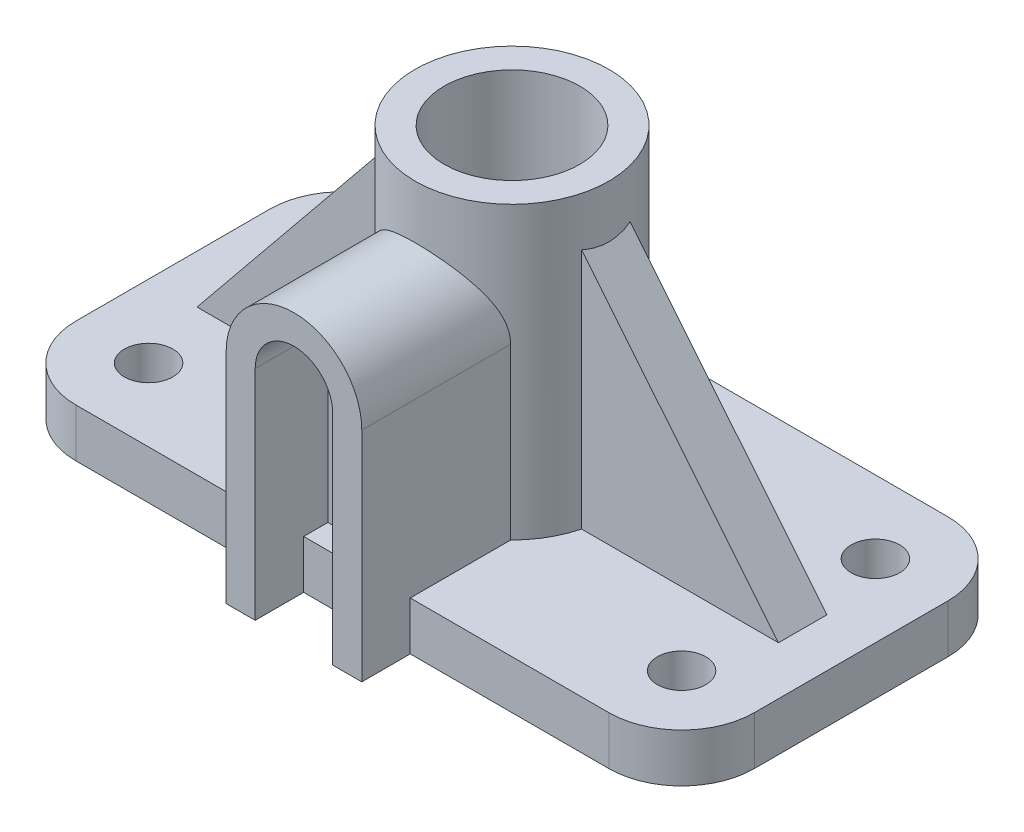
SolidWorks part; units mm, degrees
ref_plane "前视基准面" through (0, 0, 0) normal (0, 0, 1) x (1, 0, 0)
ref_plane "上视基准面" through (0, 0, 0) normal (0, 1, 0) x (1, 0, 0)
ref_plane "右视基准面" through (0, 0, 0) normal (1, 0, 0) x (0, 0, -1)
sketch "草图1" plane through (0, 0, 0) normal (0, 1, 0) x (1, 0, 0)
  line L0 (0, 0) -> (120.431, 0) construction
  line L1 (-55, 35) -> (55, 35)
  line L2 (-70, 20) -> (-70, -20)
  line L3 (-55, -35) -> (55, -35)
  line L4 (70, 20) -> (70, -20)
  line L5 (0, 0) -> (0, 97.1477) construction
  arc A0 (-70, 20) -> (-55, 35) centre (-55, 20) cw
  arc A1 (-55, -35) -> (-70, -20) centre (-55, -20) cw
  arc A2 (70, 20) -> (55, 35) centre (55, 20) ccw
  arc A3 (55, -35) -> (70, -20) centre (55, -20) ccw
  circle A4 centre (55, 20) radius 5
  circle A5 centre (55, -20) radius 5
  circle A6 centre (-55, 20) radius 5
  circle A7 centre (-55, -20) radius 5
  point P10 (-70, 35)
  point P15 (70, 35)
  dimension "D3" = 15
  dimension "D4" = 15
  dimension "D5" = 15
  dimension "D6" = 10
  dimension "D7" = 10
  dimension "D8" = 10
  dimension "D9" = 10
  dimension "D1" = 140
  dimension "D2" = 70
extrude "拉伸1" add sketch "草图1" along normal blind 10
sketch "草图2" plane through (0, 10, 0) normal (0, 1, 0) x (1, 0, 0)
  circle A0 centre (0, 0) radius 20
  dimension "D1" = 40
extrude "拉伸2" add sketch "草图2" along normal blind 60
sketch "草图3" plane through (0, 70, 0) normal (0, 1, 0) x (1, 0, 0)
  circle A0 centre (0, 0) radius 7.5
  dimension "D1" = 15
extrude "切除-拉伸1" cut sketch "草图3" against normal through all
sketch "草图4" plane through (0, 70, 0) normal (0, 1, 0) x (1, 0, 0)
  circle A0 centre (0, 0) radius 14
  dimension "D1" = 28
extrude "切除-拉伸2" cut sketch "草图4" against normal blind 40
sketch "草图5" plane through (0, 0, 0) normal (0, 0, 1) x (1, 0, 0)
  line L0 (-20, 59.1379) -> (-60, 10)
  line L1 (-20, 70) -> (-20, 10) construction
rib "筋1" sketch "草图5" sketch "草图5" thickness 10 extrusion direction parallel to sketch draft on no parameters "D1"=10
mirror "镜向1" about plane through (0, 0, 0) normal (1, 0, 0) of "筋1"
ref_plane "基准面1" through (0, 0, 45) normal (0, 0, 1) x (1, 0, 0)
sketch "草图6" plane through (0, 0, 45) normal (0, 0, 1) x (1, 0, 0)
  line L0 (-8, 0) -> (-8, 45)
  line L1 (-55, 0) -> (55, 0) construction
  line L2 (8, 45) -> (8, 0)
  line L4 (0, 0) -> (0, 54.1762) construction
  line L5 (14, 45) -> (14, 0)
  line L6 (-8, 0) -> (-14, 0)
  line L7 (-14, 0) -> (-14, 45)
  line L8 (14, -6) -> (-14, -6) construction
  line L9 (8, 0) -> (14, 0)
  line L10 (14, 45) -> (14, -6) construction
  line L11 (-14, -6) -> (-14, 45) construction
  line L12 (8, 0) -> (-8, 0) construction
  arc A0 (-8, 45) -> (8, 45) centre (0, 45) cw
  arc A1 (-14, 45) -> (14, 45) centre (0, 45) cw
  dimension "D1" = 8
  dimension "D2" = 45
  dimension "D3" = 6
extrude "拉伸3" add sketch "草图6" against normal up to surface (26.6697 mm away)
ref_plane "基准面2" through (0, 0, 30) normal (0, 0, 1) x (1, 0, 0)
sketch "草图7" plane through (0, 0, 30) normal (0, 0, 1) x (1, 0, 0)
  line L0 (8, 45) -> (8, 0) construction
  line L1 (-8, 45) -> (-8, 10) construction
  line L2 (8, 45) -> (8, 10)
  line L3 (-8, 45) -> (-8, 10)
  line L4 (-8, 10) -> (8, 10)
  arc A0 (8, 45) -> (-8, 45) centre (0, 45) ccw construction
  arc A1 (8, 45) -> (-8, 45) centre (0, 45) ccw
extrude "拉伸4" add sketch "草图7" against normal up to next
sketch "草图8" plane through (0, 0, 30) normal (0, 0, 1) x (1, 0, 0)
  circle A0 centre (0, 45) radius 8
extrude "切除-拉伸3" cut sketch "草图8" against normal blind 30
